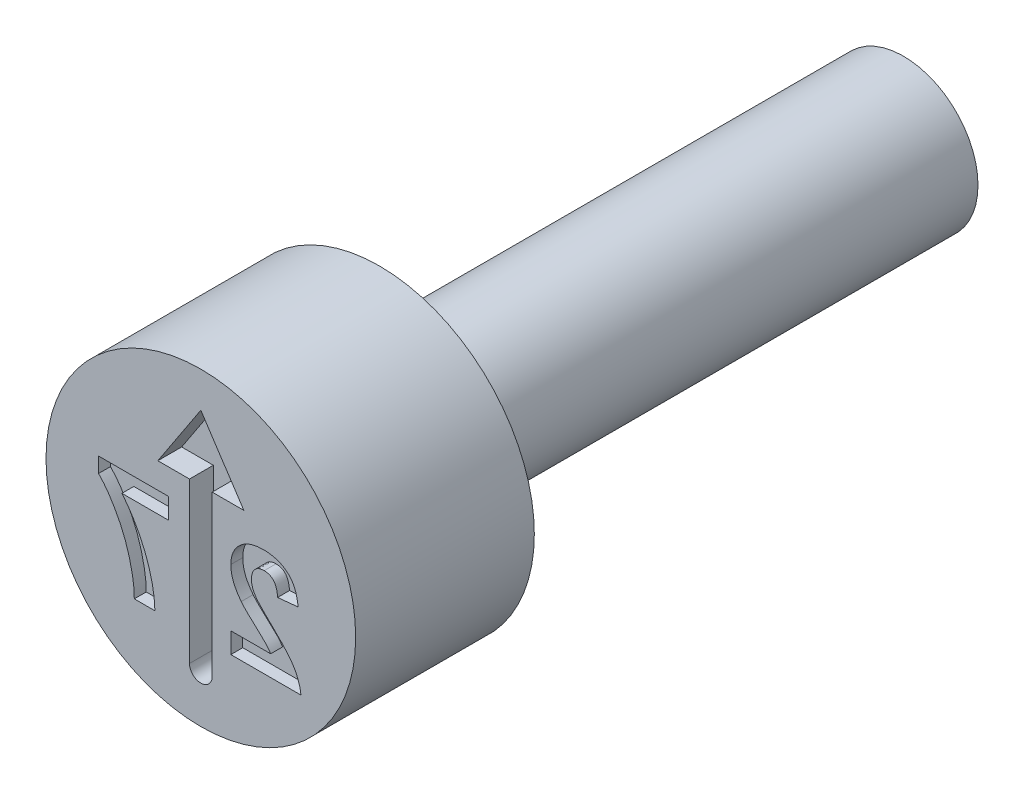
SolidWorks part; units mm, degrees
ref_plane "Front Plane" through (0, 0, 0) normal (0, 0, 1) x (1, 0, 0)
ref_plane "Top Plane" through (0, 0, 0) normal (0, 1, 0) x (1, 0, 0)
ref_plane "Right Plane" through (0, 0, 0) normal (1, 0, 0) x (0, 0, -1)
sketch "Sketch2" plane through (0, 0, 0) normal (1, 0, 0) x (0, 0, -1)
  line L0 (0.4039, 0) -> (50000.4039, 0) construction
  line L6 (0, 2.6) -> (0, 0)
  line L7 (3, 2.6) -> (0, 2.6)
  line L8 (3, 1.25) -> (3, 2.6)
  line L9 (11.8, 1.25) -> (3, 1.25)
  line L10 (11.8, 0) -> (11.8, 1.25)
  line L11 (0, 0) -> (11.8, 0)
  dimension "D1" = 5.2
  dimension "D2" = 2.5
  dimension "D3" = 11.8
  dimension "D4" = 3
revolve "Revolve1" add sketch "Sketch2" angle 360 about L0
sketch "Sketch3" plane through (0, 0, 0) normal (0, 0, 1) x (1, 0, 0)
  line L0 (0, 0) -> (0, 100000) construction
  line L1 (0.1905, 0.9064) -> (0.1905, -1.7762)
  line L2 (0.7219, 0.9064) -> (0.1905, 0.9064)
  line L3 (0, 2.0021) -> (0.7219, 0.9064)
  line L15 (0, 2.0021) -> (-0.7219, 0.9064)
  line L16 (-0.7219, 0.9064) -> (-0.1905, 0.9064)
  line L17 (-0.1905, 0.9064) -> (-0.1905, -1.7762)
  arc A2 (-0.1905, -1.7762) -> (0.1905, -1.7762) centre (0, -1.7762) ccw
extrude "Cut-Extrude4" cut sketch "Sketch3" against normal blind 0.4
sketch "Sketch4" plane through (0, 0, 0) normal (0, 0, 1) x (1, 0, 0)
  text T0 "2  7  " font "Arial" height 1.8
  dimension "D1" = 1.3
extrude "Cut-Extrude5" cut sketch "Sketch4" against normal blind 0.2
